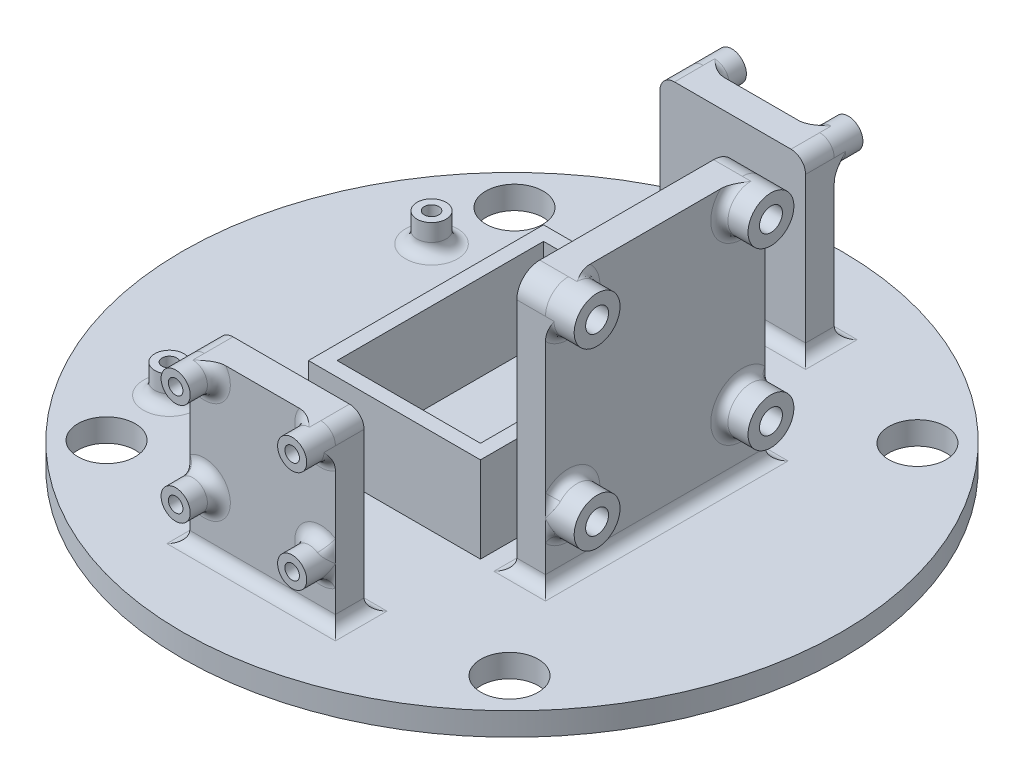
SolidWorks part; units mm, degrees
ref_plane "Front Plane" through (0, 0, 0) normal (0, 0, 1) x (1, 0, 0)
ref_plane "Top Plane" through (0, 0, 0) normal (0, 1, 0) x (1, 0, 0)
ref_plane "Right Plane" through (0, 0, 0) normal (1, 0, 0) x (0, 0, -1)
sketch "Sketch1" plane through (0, 0, 0) normal (0, 1, 0) x (1, 0, 0)
  circle A0 centre (0, 0) radius 57.5
  dimension "D1" = 115
extrude "Boss-Extrude1" add sketch "Sketch1" along normal blind 4
sketch "Sketch2" plane through (0, 4, 0) normal (0, 1, 0) x (1, 0, 0)
  circle A0 centre (-35.1391, 35.5703) radius 5
  circle A1 centre (35.5703, 35.1391) radius 5
  circle A2 centre (35.1391, -35.5703) radius 5
  circle A3 centre (-35.5703, -35.1391) radius 5
  point P12 (0, 0)
  dimension "D1" = 10
  dimension "D2" = 50
  dimension "D3" = 4
extrude "Cut-Extrude1" cut sketch "Sketch2" against normal through all
sketch "Sketch3" plane through (0, 4, 0) normal (0, 1, 0) x (1, 0, 0)
  line L1 (-12.5, -18) -> (12.5, -18)
  line L2 (-12.5, -18) -> (-12.5, 18)
  line L3 (-12.5, 18) -> (12.5, 18)
  line L4 (12.5, -18) -> (12.5, 18)
  line L5 (-12.5, -18) -> (12.5, 18) construction
  line L6 (-12.5, 18) -> (12.5, -18) construction
  line L7 (-15, -20.5) -> (15, -20.5)
  line L8 (-15, -20.5) -> (-15, 20.5)
  line L9 (-15, 20.5) -> (15, 20.5)
  line L10 (15, -20.5) -> (15, 20.5)
  line L11 (-15, -20.5) -> (15, 20.5) construction
  line L12 (-15, 20.5) -> (15, -20.5) construction
  point P0 (0, 0)
  point P6 (0, 0)
  dimension "D1" = 25
  dimension "D2" = 30
  dimension "D3" = 36
  dimension "D4" = 41
extrude "Boss-Extrude2" add sketch "Sketch3" along normal blind 15
sketch "Sketch4" plane through (0, 4, 0) normal (0, 1, 0) x (1, 0, 0)
  line L0 (-19.11, 22.86) -> (-36.89, -22.86) construction
  line L1 (-36.89, -22.86) -> (-36.89, 22.86) construction
  line L2 (-36.89, 22.86) -> (-19.11, 22.86) construction
  line L3 (-19.11, 22.86) -> (-19.11, -22.86) construction
  line L4 (-19.11, -22.86) -> (-36.89, -22.86) construction
  line L5 (-36.89, 22.86) -> (-19.11, -22.86) construction
  line L6 (-15, 20.5) -> (-15, -20.5) construction
  circle A0 centre (-19.11, 22.86) radius 2.54
  circle A1 centre (-36.89, 22.86) radius 2.54
  circle A2 centre (-19.11, -22.86) radius 2.54
  circle A3 centre (-36.89, -22.86) radius 2.54
  circle A4 centre (-36.89, 22.86) radius 1.27
  circle A5 centre (-19.11, 22.86) radius 1.27
  circle A6 centre (-19.11, -22.86) radius 1.27
  circle A7 centre (-36.89, -22.86) radius 1.27
  point P8 (-28, 0)
  dimension "D1" = 5.08
  dimension "D2" = 5.08
  dimension "D3" = 5.08
  dimension "D4" = 5.08
  dimension "D10" = 2.54
  dimension "D11" = 2.54
  dimension "D12" = 2.54
  dimension "D13" = 2.54
  dimension "D5" = 45.72
  dimension "D6" = 45.72
  dimension "D7" = 17.78
  dimension "D8" = 20.5
  dimension "D9" = 13
extrude "Boss-Extrude3" add sketch "Sketch4" along normal blind 5
sketch "Sketch5" plane through (0, 4, 0) normal (0, 1, 0) x (1, 0, 0)
  line L0 (-15, -20.5) -> (15, -20.5) construction
  line L1 (-12.7, 38.5) -> (12.7, 38.5)
  line L2 (-12.7, 38.5) -> (-12.7, 43.5)
  line L3 (-12.7, 43.5) -> (12.7, 43.5)
  line L4 (12.7, 38.5) -> (12.7, 43.5)
  line L5 (-12.7, 38.5) -> (12.7, 43.5) construction
  line L6 (-12.7, 43.5) -> (12.7, 38.5) construction
  line L7 (-12.7, -38.5) -> (12.7, -38.5)
  line L8 (-12.7, -38.5) -> (-12.7, -43.5)
  line L9 (-12.7, -43.5) -> (12.7, -43.5)
  line L10 (12.7, -38.5) -> (12.7, -43.5)
  line L11 (-12.7, -38.5) -> (12.7, -43.5) construction
  line L12 (-12.7, -43.5) -> (12.7, -38.5) construction
  line L13 (15, 20.5) -> (-15, 20.5) construction
  point P0 (0, 41)
  point P5 (0, -41)
  dimension "D1" = 5
  dimension "D2" = 5
  dimension "D3" = 25.4
  dimension "D4" = 25.4
  dimension "D5" = 18
  dimension "D6" = 18
extrude "Boss-Extrude4" add sketch "Sketch5" along normal blind 30
sketch "Sketch6" plane through (0, 0, 43.5) normal (0, 0, 1) x (1, 0, 0)
  line L0 (-12.7, 34) -> (-12.7, 4) construction
  line L1 (-12.7, 34) -> (12.7, 34) construction
  line L2 (12.7, 34) -> (12.7, 4) construction
  circle A0 centre (-10.16, 31.46) radius 1.27
  circle A1 centre (-10.16, 31.46) radius 2.54
  circle A2 centre (10.16, 31.46) radius 1.27
  circle A3 centre (10.16, 31.46) radius 2.54
  circle A4 centre (-10.16, 13.68) radius 1.27
  circle A5 centre (-10.16, 13.68) radius 2.54
  circle A6 centre (10.16, 13.68) radius 1.27
  circle A7 centre (10.16, 13.68) radius 2.54
  dimension "D1" = 2.54
  dimension "D2" = 2.54
  dimension "D3" = 5.08
  dimension "D4" = 5.08
  dimension "D9" = 2.54
  dimension "D10" = 5.08
  dimension "D11" = 2.54
  dimension "D12" = 5.08
  dimension "D5" = 2.54
  dimension "D6" = 2.54
  dimension "D7" = 2.54
  dimension "D8" = 2.54
  dimension "D13" = 17.78
  dimension "D14" = 17.78
extrude "Boss-Extrude5" add sketch "Sketch6" along normal blind 5
sketch "Sketch7" plane through (0, 0, -43.5) normal (0, 0, -1) x (-1, 0, 0)
  line L0 (-12.7, 34) -> (12.7, 34) construction
  line L1 (-12.7, 34) -> (-12.7, 4) construction
  line L2 (12.7, 34) -> (12.7, 4) construction
  circle A0 centre (-10.16, 31.46) radius 1.27
  circle A1 centre (-10.16, 31.46) radius 2.54
  circle A2 centre (10.16, 31.46) radius 1.27
  circle A3 centre (10.16, 31.46) radius 2.54
  dimension "D1" = 2.54
  dimension "D2" = 5.08
  dimension "D3" = 2.54
  dimension "D4" = 5.08
  dimension "D5" = 2.54
  dimension "D6" = 2.54
  dimension "D7" = 2.54
  dimension "D8" = 2.54
extrude "Boss-Extrude6" add sketch "Sketch7" along normal blind 5
fillet "Fillet1" radius 2.54 4 edges at (12.7, 34, 41) (-12.7, 34, 41) (-12.7, 34, -41) (12.7, 34, -41)
sketch "Sketch9" plane through (0, 4, 0) normal (0, 1, 0) x (1, 0, 0)
  line L1 (20, 19.16) -> (25, 19.16)
  line L2 (20, 19.16) -> (20, -19.16)
  line L3 (20, -19.16) -> (25, -19.16)
  line L4 (25, 19.16) -> (25, -19.16)
  line L5 (20, 19.16) -> (25, -19.16) construction
  line L6 (20, -19.16) -> (25, 19.16) construction
  line L7 (15, 20.5) -> (-15, 20.5) construction
  line L8 (15, -20.5) -> (15, 20.5) construction
  point P0 (22.5, 0)
  point P6 (22.5, 19.16)
  dimension "D1" = 5
  dimension "D2" = 38.32
  dimension "D3" = 1.34
  dimension "D4" = 5
extrude "Boss-Extrude7" add sketch "Sketch9" along normal blind 45
sketch "Sketch11" plane through (25, 0, 0) normal (1, 0, 0) x (0, 0, -1)
  line L0 (-19.16, 49) -> (-19.16, 4) construction
  line L3 (-19.16, 49) -> (19.16, 49) construction
  circle A0 centre (-15.16, 45) radius 2
  circle A1 centre (-15.16, 45) radius 4
  circle A2 centre (15.16, 45) radius 2
  circle A3 centre (15.16, 45) radius 4
  circle A4 centre (15.16, 14.5) radius 2
  circle A5 centre (15.16, 14.5) radius 4
  circle A6 centre (-15.16, 14.5) radius 2
  circle A7 centre (-15.16, 14.5) radius 4
  dimension "D1" = 4
  dimension "D2" = 4
  dimension "D3" = 4
  dimension "D4" = 4
  dimension "D5" = 8
  dimension "D6" = 8
  dimension "D7" = 8
  dimension "D8" = 8
  dimension "D9" = 30.5
  dimension "D10" = 30.5
  dimension "D11" = 30.32
extrude "Boss-Extrude8" add sketch "Sketch11" along normal blind 5
fillet "Fillet2" radius 4 2 edges at (22.5, 49, -19.16) (22.5, 49, 19.16)
fillet "Fillet3" radius 2 22 edges at (20, 4, 0) (22.5, 4, 19.16) (22.5, 4, -19.16) (25, 4, 0) (12.7, 4, -41) (0, 4, -43.5) (0, 4, -38.5) (-12.7, 4, -41) (-12.7, 4, 41) (0, 4, 38.5) (12.7, 4, 41) (0, 4, 43.5) (-36.89, 4, -20.32) (-19.11, 4, -20.32) (-36.89, 4, 25.4) (-19.11, 4, 25.4) (-7.62, 13.68, 43.5) (12.7, 13.68, 43.5) (8.3639, 29.6639, 43.5) (-8.3639, 29.6639, 43.5) (-8.3639, 29.6639, -43.5) (8.3639, 29.6639, -43.5)
fillet "Fillet4" radius 1.5 4 edges at (25, 14.5, 11.16) (25, 14.5, -19.16) (25, 42.1716, -12.3316) (25, 42.1716, 12.3316)
